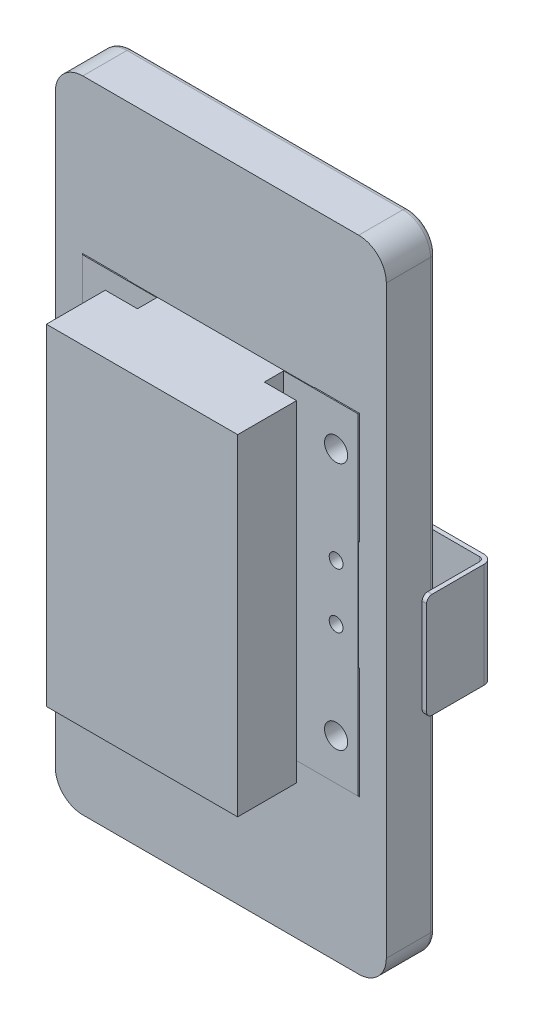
SolidWorks part; units mm, degrees
ref_plane "前视" through (0, 0, 0) normal (0, 0, 1) x (1, 0, 0)
ref_plane "上视" through (0, 0, 0) normal (0, 1, 0) x (1, 0, 0)
ref_plane "右视" through (0, 0, 0) normal (1, 0, 0) x (0, 0, -1)
imported_body "输入1"
sketch "草图1" plane through (0, 0, -54.5) normal (0, 0, -1) x (-1, 0, 0)
  line L0 (-25, 92.5) -> (-25, 112.5) construction
  circle A1 centre (-21, 97.5) radius 1.5
  circle A2 centre (21, 67.5) radius 1.5
  circle A3 centre (-21, 105) radius 2.1 construction
  dimension "D1" = 3
  dimension "D2" = 3
  dimension "D3" = 4
  dimension "D4" = 30
  dimension "D5" = 42
  dimension "D6" = 7.5
extrude "切除-拉伸1" cut sketch "草图1" against normal blind 6
ref_plane "基准面1" through (0, 82.5, 0) normal (0, -1, 0) x (-1, 0, 0)
hole_wizard "大小mm 暗销孔1" positions "草图3" profile "草图2" hole size "Ø3.0" standard "Gb"
sketch "草图3" plane through (0, 0, -54.5) normal (0, 0, -1) x (-1, 0, 0)
  circle A0 centre (21, 105) radius 2.1 construction
  circle A1 centre (-21, 60) radius 2.1 construction
  circle A2 centre (-21, 97.5) radius 1.5 construction
  circle A3 centre (21, 67.5) radius 1.5 construction
  point P0 (-21, 67.5)
  point P2 (21, 97.5)
  dimension "D1" = 7.5
  dimension "D2" = 7.5
  dimension "D3" = 42
  dimension "D4" = 42
sketch "草图2" plane through (21, 67.5, -54.5) normal (1, 0, 0) x (0, 1, 0)
  line L0 (0, 0) -> (0, 6.5131)
  line L1 (0, 6.5131) -> (1.5, 6.5)
  line L2 (1.5, 6.5) -> (1.5, 0)
  line L5 (1.5, 0) -> (0, 0)
  line L10 (0, 6.5131) -> (-1.5, 6.5) construction
  line L11 (0, -6.35) -> (0, 107.95) construction
  dimension "孔直径" = 3
  dimension "孔深度" = 6.5
  dimension "导头角度" = 179
